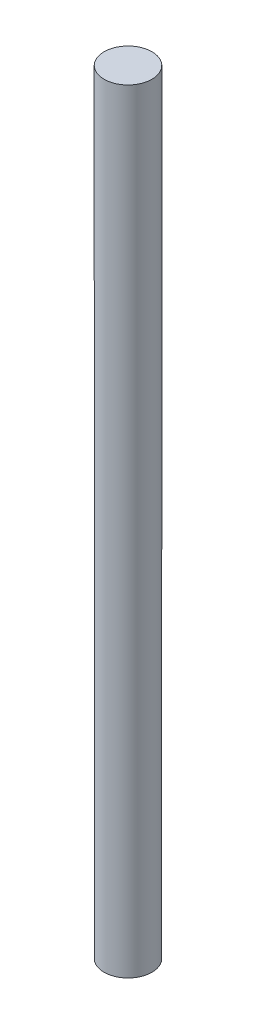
SolidWorks part; units mm, degrees
ref_plane "Front Plane" through (0, 0, 0) normal (0, 0, 1) x (1, 0, 0)
ref_plane "Top Plane" through (0, 0, 0) normal (0, 1, 0) x (1, 0, 0)
ref_plane "Right Plane" through (0, 0, 0) normal (1, 0, 0) x (0, 0, -1)
sketch "Sketch1" plane through (0, 0, 0) normal (0, 1, 0) x (1, 0, 0)
  circle A0 centre (0, 0) radius 6.35
  dimension "D1" = 12.7
extrude "Boss-Extrude1" add sketch "Sketch1" along normal offset from surface (205.5813 mm away) 10.16
